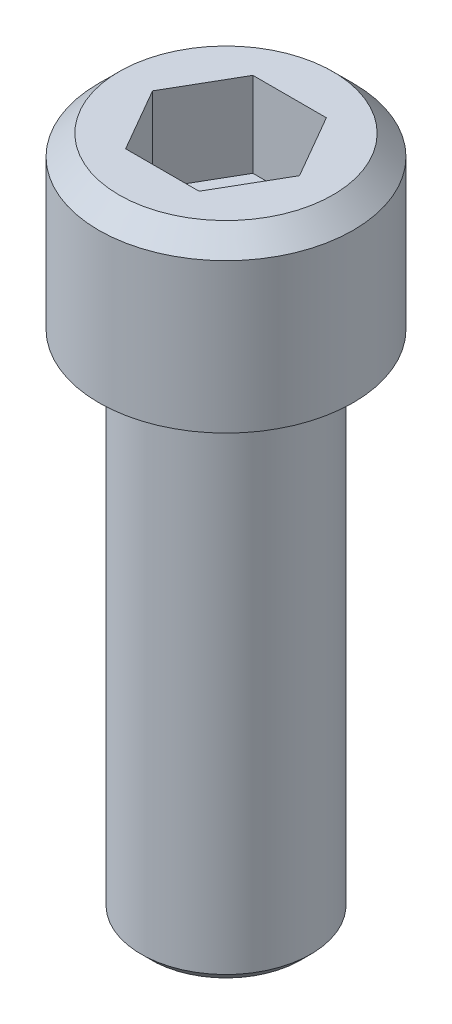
SolidWorks part; units mm, degrees
ref_plane "Plane1" through (0, 0, 0) normal (0, 0, 1) x (1, 0, 0)
ref_plane "Plane2" through (0, 0, 0) normal (0, 1, 0) x (1, 0, 0)
ref_plane "Plane3" through (0, 0, 0) normal (1, 0, 0) x (0, 0, -1)
sketch "Sketch1" plane through (0, 0, 0) normal (0, 0, 1) x (1, 0, 0)
  line L0 (0, 0) -> (0, 43.6223) construction
  line L1 (6.35, 0) -> (9.525, 0)
  line L2 (9.525, 0) -> (9.525, 12.7)
  line L3 (9.525, 12.7) -> (0, 12.7)
  line L4 (0, 12.7) -> (0, -38.1)
  line L5 (0, -38.1) -> (6.35, -38.1)
  line L6 (6.35, -38.1) -> (6.35, 0)
  line L7 (50, 0) -> (-50, 0) construction
  dimension "D1" = 19.05
  dimension "D2" = 12.7
  dimension "D3" = 12.7
  dimension "D4" = 38.1
revolve "Base-Revolve" add sketch "Sketch1" angle 360 about L0
sketch "Sketch2" plane through (0, 12.7, 0) normal (0, 1, 0) x (-1, 0, 0)
  line L0 (2.7496, -4.7625) -> (-2.7496, -4.7625)
  line L1 (-5.4993, 0) -> (-2.7496, -4.7625)
  line L2 (0, 0) -> (0, -4.7625) construction
  line L3 (0, 0) -> (-5.4993, 0) construction
  line L4 (5.4993, 0) -> (2.7496, -4.7625)
  line L5 (5.4993, 0) -> (2.7496, 4.7625)
  line L6 (-5.4993, 0) -> (-2.7496, 4.7625)
  line L7 (2.7496, 4.7625) -> (-2.7496, 4.7625)
  circle A0 centre (0, 0) radius 4.7625 construction
  point P12 (0, -4.7625)
  point P14 (0, 4.7625)
  dimension "D2" = 9.525
extrude "Cut-Extrude1" cut sketch "Sketch2" against normal blind 6.35
chamfer "Chamfer1" distance 1.524 angle 45 1 edges at (0, 12.7, -9.525)
chamfer "Chamfer2" distance 0.762 angle 45 1 edges at (0, -38.1, -6.35)
